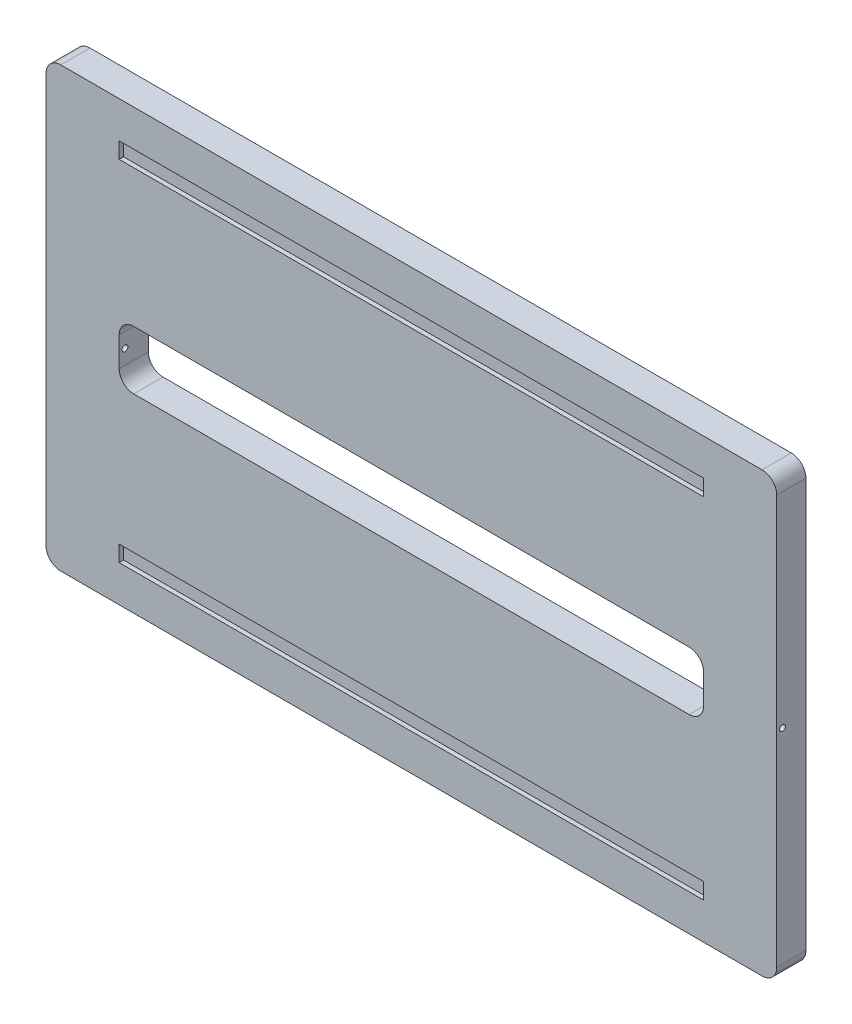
SolidWorks part; units mm, degrees
ref_plane "Plan de face" through (0, 0, 0) normal (0, 0, 1) x (1, 0, 0)
ref_plane "Plan de dessus" through (0, 0, 0) normal (0, 1, 0) x (1, 0, 0)
ref_plane "Plan de droite" through (0, 0, 0) normal (1, 0, 0) x (0, 0, -1)
sketch "Esquisse1" plane through (0, 0, 0) normal (0, 0, 1) x (1, 0, 0)
  line L1 (0, 0) -> (500, 0)
  line L2 (0, 0) -> (0, 300)
  line L3 (0, 300) -> (500, 300)
  line L4 (500, 0) -> (500, 300)
  dimension "D1" = 500
  dimension "D2" = 300
extrude "Boss.-Extru.1" add sketch "Esquisse1" along normal blind 20
sketch "Esquisse2" plane through (500, 0, 0) normal (1, 0, 0) x (0, 0, -1)
  line L0 (0, 0) -> (0, 300) construction
  line L1 (-17, 25) -> (-28, 25)
  line L2 (-17, 25) -> (-17, 36)
  line L3 (-17, 36) -> (-28, 36)
  line L4 (-28, 25) -> (-28, 36)
  line L5 (-20, 0) -> (0, 0) construction
  line L6 (0, 150) -> (-20, 150) construction
  line L7 (-20, 0) -> (-20, 300) construction
  dimension "D1" = 11
  dimension "D2" = 11
  dimension "D3" = 17
  dimension "D4" = 25
extrude "Enlèv. mat.-Extru.1" cut sketch "Esquisse2" against normal blind 450
sketch "Esquisse3" plane through (0, 0, 17) normal (0, 0, 1) x (1, 0, 0)
  line L0 (50, 25) -> (500, 25) construction
  line L1 (500, 36) -> (450, 36)
  line L2 (500, 36) -> (500, 25)
  line L3 (500, 25) -> (450, 25)
  line L4 (450, 36) -> (450, 25)
  dimension "D1" = 50
extrude "Boss.-Extru.2" add sketch "Esquisse3" along normal blind 3
sketch "Esquisse4" plane through (500, 0, 0) normal (1, 0, 0) x (0, 0, -1)
  line L0 (0, 0) -> (0, 300) construction
  line L1 (-17, 275) -> (-28, 275)
  line L2 (-17, 275) -> (-17, 264)
  line L3 (-17, 264) -> (-28, 264)
  line L4 (-28, 275) -> (-28, 264)
  line L5 (-20, 300) -> (0, 300) construction
  dimension "D1" = 11
  dimension "D2" = 11
  dimension "D3" = 17
  dimension "D4" = 25
extrude "Enlèv. mat.-Extru.2" cut sketch "Esquisse4" against normal blind 450
sketch "Esquisse5" plane through (0, 0, 17) normal (0, 0, 1) x (1, 0, 0)
  line L0 (50, 275) -> (500, 275) construction
  line L1 (500, 264) -> (450, 264)
  line L2 (500, 264) -> (500, 275)
  line L3 (500, 275) -> (450, 275)
  line L4 (450, 264) -> (450, 275)
  dimension "D1" = 50
extrude "Boss.-Extru.3" add sketch "Esquisse5" along normal blind 3
fillet "Congé1" radius 10 4 edges at (0, 300, 10) (500, 300, 10) (0, 0, 10) (500, 0, 10)
sketch "Esquisse6" plane through (0, 0, 20) normal (0, 0, 1) x (1, 0, 0)
  line L0 (0, 150) -> (500, 150) construction
  line L1 (0, 290) -> (0, 10) construction
  line L2 (500, 10) -> (500, 290) construction
  line L4 (50, 130) -> (450, 130)
  line L5 (50, 130) -> (50, 170)
  line L6 (50, 170) -> (450, 170)
  line L7 (450, 130) -> (450, 170)
  dimension "D1" = 40
  dimension "D2" = 20
  dimension "D3" = 400
  dimension "D4" = 50
extrude "Enlèv. mat.-Extru.3" cut sketch "Esquisse6" against normal through all
fillet "Congé2" radius 10 4 edges at (450, 170, 10) (450, 130, 10) (50, 170, 10) (50, 130, 10)
sketch "Esquisse7" plane through (500, 0, 0) normal (1, 0, 0) x (0, 0, -1)
  line L0 (-20, 10) -> (-20, 290) construction
  circle A0 centre (-16, 150) radius 2
  dimension "D1" = 4
  dimension "D2" = 4
extrude "Enlèv. mat.-Extru.4" cut sketch "Esquisse7" against normal through all
